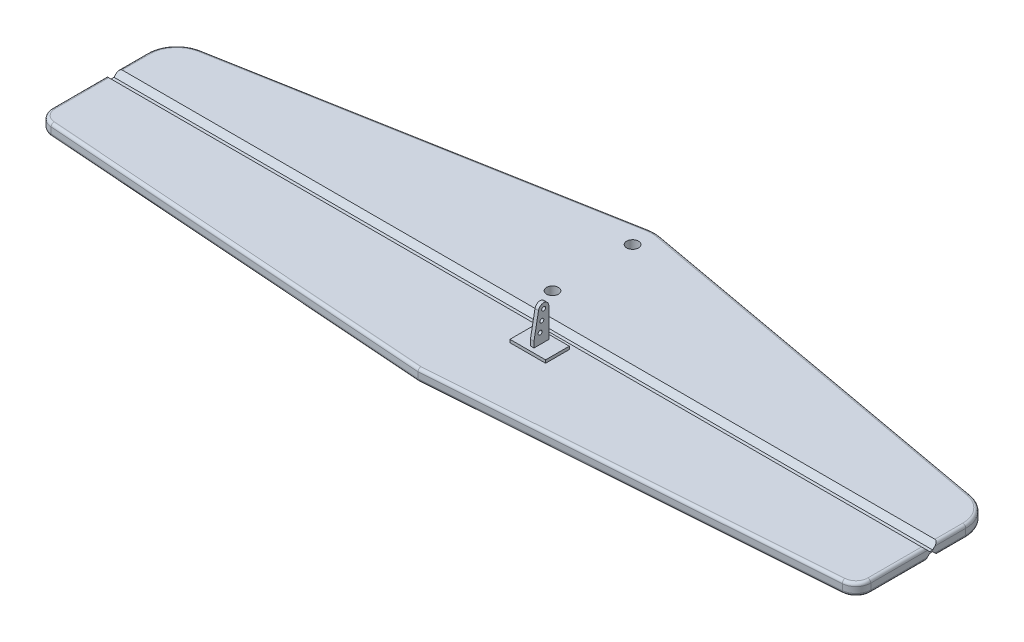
SolidWorks part; units mm, degrees
ref_plane "Plan de face" through (0, 0, 0) normal (0, 0, 1) x (1, 0, 0)
ref_plane "Plan de dessus" through (0, 0, 0) normal (0, 1, 0) x (1, 0, 0)
ref_plane "Plan de droite" through (0, 0, 0) normal (1, 0, 0) x (0, 0, -1)
sketch "Esquisse1" plane through (0, 0, 0) normal (0, 1, 0) x (1, 0, 0)
  line L0 (0, -45.2106) -> (0, 85.778) construction
  line L1 (-25.9045, 0) -> (154.6499, 0) construction
  line L2 (158.5786, 45) -> (-16.4133, 45) construction
  line L3 (165.2268, -35) -> (-25.9045, -35) construction
  line L4 (138, 48.6669) -> (138, -39.0051) construction
  line L5 (116.3831, 20) -> (148.5122, 20) construction
  line L6 (119.9118, -25) -> (152.4123, -25) construction
  line L7 (0, -35) -> (133.3614, -25.3361)
  line L8 (138, -20.3492) -> (138, 11.6488)
  line L9 (129.7826, 21.4887) -> (1.7826, 44.6771)
  line L10 (-129.7826, 21.4887) -> (-1.7826, 44.6771)
  line L11 (-138, -20.3492) -> (-138, 11.6488)
  line L12 (0, -35) -> (-133.3614, -25.3361)
  line L13 (-14.5036, 37.3372) -> (3.474, 37.3372) construction
  line L14 (-14.5036, 10.3372) -> (3.474, 10.3372) construction
  line L15 (-2.9022, 44.8372) -> (6.4278, 44.8372) construction
  arc A0 (138, 11.6488) -> (129.7826, 21.4887) centre (128, 11.6488) ccw
  arc A1 (133.3614, -25.3361) -> (138, -20.3492) centre (133, -20.3492) ccw
  arc A2 (-138, 11.6488) -> (-129.7826, 21.4887) centre (-128, 11.6488) cw
  arc A3 (-133.3614, -25.3361) -> (-138, -20.3492) centre (-133, -20.3492) cw
  circle A4 centre (0, 37.3372) radius 2
  circle A5 centre (0, 10.3372) radius 2
  arc A6 (1.7826, 44.6771) -> (-1.7826, 44.6771) centre (0, 34.8372) ccw
  point P21 (138, 20)
  point P24 (138, -25)
  point P41 (0, 45)
  dimension "D6" = 10
  dimension "D7" = 5
  dimension "D9" = 10
  dimension "D1" = 138
  dimension "D2" = 45
  dimension "D3" = 80
  dimension "D4" = 20
  dimension "D5" = 25
  dimension "D8" = 27
  dimension "D10" = 7.5
extrude "Boss.-Extru.1" add sketch "Esquisse1" along normal blind 4
sketch "Esquisse3" plane through (138, 0, 0) normal (1, 0, 0) x (0, 0, -1)
  line L0 (0, -7.466) -> (0, 23.0269) construction
  line L1 (-36.2261, 2) -> (3.3735, 2) construction
  line L2 (-36.2261, 0) -> (2.3966, 0) construction
  line L3 (-20.3492, 0) -> (11.6488, 0) construction
  line L4 (-0.5, 5.4527) -> (-0.5, 1.5373) construction
  line L5 (-1.5064, 2.25) -> (0.8273, 2.25) construction
  line L6 (-0.5, 2.25) -> (-3.3187, 5.0687) construction
  line L7 (0.5, 2.25) -> (-0.5, 2.25)
  line L8 (-0.5, 2.25) -> (-2.25, 4)
  line L9 (-20.3492, 4) -> (11.6488, 4) construction
  line L10 (-2.25, 4) -> (2.25, 4)
  line L11 (0.5, 2.25) -> (2.25, 4)
  line L12 (0.5, 1.75) -> (2.25, 0)
  line L13 (0.5, 1.75) -> (-0.5, 1.75)
  line L14 (-0.5, 1.75) -> (-2.25, 0)
  line L15 (-2.25, 0) -> (2.25, 0)
  dimension "D1" = 2
  dimension "D2" = 0.25
  dimension "D3" = 0.5
  dimension "D4" = 45
extrude "Enlèv. mat.-Extru.1" cut sketch "Esquisse3" against normal through all
fillet "Congé1" radius 1 26 edges at (-138, 0, 11.2996) (-136.6611, 0, 23.7546) (66.6807, 0, 30.1681) (136.6611, 0, 23.7546) (-138, 0, -6.9494) (-135.6755, 0, -18.0587) (-65.7826, 0, -33.0829) (0, 0, -44.8372) (65.7826, 0, -33.0829) (135.6755, 0, -18.0587) (138, 4, 11.2996) (136.6611, 4, 23.7546) (-66.6807, 4, 30.1681) (-136.6611, 4, 23.7546) (-138, 4, -6.9494) (-135.6755, 4, -18.0587) (-65.7826, 4, -33.0829) (0, 4, -44.8372) (65.7826, 4, -33.0829) (135.6755, 4, -18.0587) (-66.6807, 0, 30.1681) (138, 0, 11.2996) (138, 0, -6.9494) (66.6807, 4, 30.1681) (-138, 4, 11.2996) (138, 4, -6.9494)
sketch "Esquisse4" plane through (0, 4, 0) normal (0, 1, 0) x (1, 0, 0)
  line L0 (0, 19.5977) -> (0, -40.6142) construction
  line L1 (8, 9.5018) -> (8, -27.093) construction
  line L2 (20, 9.5018) -> (20, -27.5193) construction
  line L3 (-4.4023, -4) -> (23.2391, -4) construction
  line L4 (-4.4023, -12) -> (23.2391, -12) construction
  line L5 (-2.4864, 0) -> (6.652, 0) construction
  line L7 (8, -4) -> (20, -4)
  line L8 (8, -4) -> (8, -12)
  line L9 (8, -12) -> (20, -12)
  line L10 (20, -4) -> (20, -12)
  dimension "D1" = 8
  dimension "D2" = 12
  dimension "D3" = 8
  dimension "D4" = 4
extrude "Boss.-Extru.2" add sketch "Esquisse4" along normal blind 1
sketch "Esquisse5" plane through (0, 5, 0) normal (0, 1, 0) x (1, 0, 0)
  line L0 (14, -12.8808) -> (14, -5.1135) construction
  line L1 (20.6017, -8) -> (13.1914, -8) construction
  line L2 (13.1914, -5.5) -> (17.709, -5.5) construction
  line L3 (14.6, -5.2489) -> (14.6, -10.899) construction
  line L4 (13.3021, -10.5) -> (17.709, -10.5) construction
  line L5 (13.4, -10.899) -> (13.4, -5.2489) construction
  line L7 (13.4, -5.5) -> (14.6, -5.5)
  line L8 (13.4, -5.5) -> (13.4, -10.5)
  line L9 (13.4, -10.5) -> (14.6, -10.5)
  line L10 (14.6, -5.5) -> (14.6, -10.5)
  dimension "D1" = 2.5
  dimension "D2" = 5
  dimension "D3" = 0.6
  dimension "D4" = 1.2
extrude "Boss.-Extru.3" add sketch "Esquisse5" along normal blind 11.6
sketch "Esquisse6" plane through (13.4, 0, 0) normal (-1, 0, 0) x (0, 0, 1)
  line L0 (4.5405, 7) -> (10.9929, 7) construction
  line L1 (9, 17.628) -> (9, 11.7134) construction
  line L2 (8.9701, 15.172) -> (10.5, 7)
  line L3 (4, 5) -> (12, 5) construction
  line L4 (7.25, 14.001) -> (7.25, 17.0023) construction
  line L5 (4.7654, 14.85) -> (7.9915, 14.85) construction
  line L6 (5.5, 16.6) -> (10.5, 16.6) construction
  line L7 (10.5, 7) -> (10.5, 17.2928)
  line L8 (10.5, 7) -> (8.6395, 16.9378) construction
  line L9 (8.9701, 15.172) -> (10.5, 7) construction
  line L10 (10.5, 7) -> (10.5, 20.6348) construction
  line L11 (10.5, 17.2928) -> (5.5, 17.2928)
  line L12 (5.5, 16.6) -> (5.5, 14.85) construction
  line L13 (5.5, 17.2928) -> (5.5, 14.85)
  line L14 (7.25, 14.85) -> (8.8372, 6.3718) construction
  line L15 (7.8481, 11.6555) -> (9.3759, 11.9415) construction
  line L16 (7.25, 14.85) -> (8.652, 15.1125) construction
  arc A0 (8.9701, 15.172) -> (5.5, 14.85) centre (7.25, 14.85) ccw
  circle A1 centre (7.25, 14.85) radius 0.65
  circle A2 centre (7.8481, 11.6555) radius 0.65
  circle A3 centre (8.4461, 8.461) radius 0.65
  dimension "D2" = 3.25
  dimension "D1" = 2
  dimension "D3" = 1.75
  dimension "D4" = 1.75
extrude "Enlèv. mat.-Extru.2" cut sketch "Esquisse6" against normal blind 1.2
